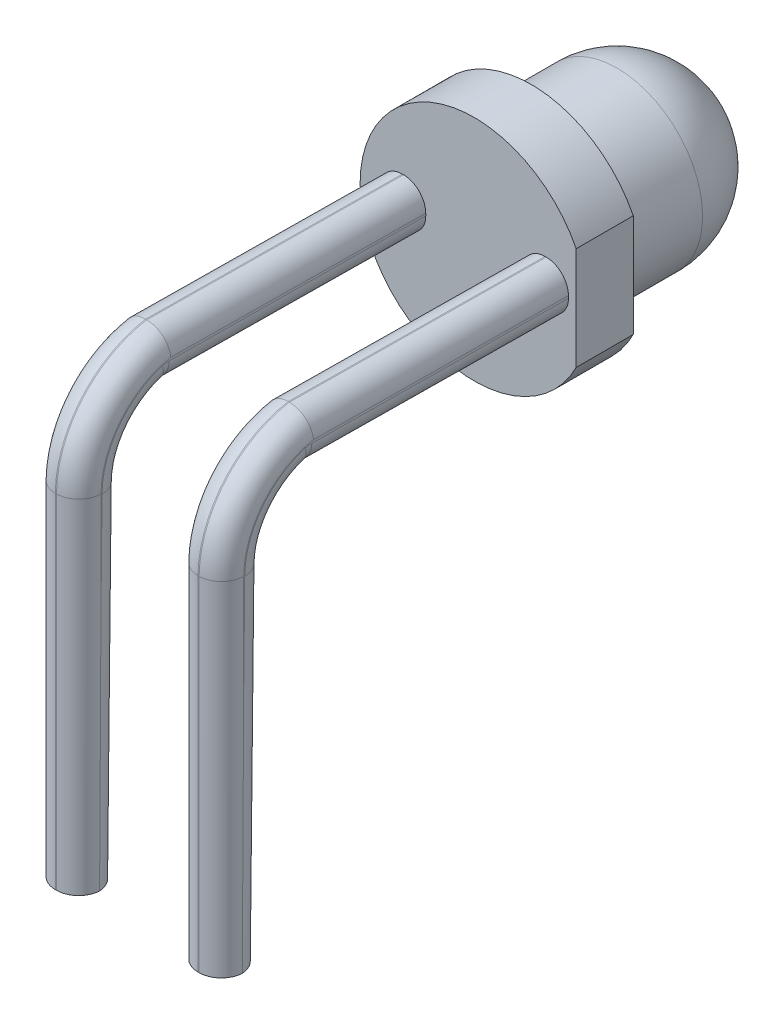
SolidWorks part; units mm, degrees
ref_plane "Face" through (0, 0, 0) normal (0, 0, 1) x (1, 0, 0)
ref_plane "Dessus" through (0, 0, 0) normal (0, 1, 0) x (1, 0, 0)
ref_plane "Droite" through (0, 0, 0) normal (1, 0, 0) x (0, 0, -1)
sketch "Esquisse1" plane through (0, 0, 0) normal (0, 0, 1) x (1, 0, 0)
  circle A0 centre (0, 0) radius 1.5
  dimension "D1" = 3
extrude "Base-Extrusion" add sketch "Esquisse1" along normal blind 4
sketch "Esquisse2" plane through (0, 0, 4) normal (0, 0, 1) x (1, 0, 0)
  line L0 (1.7857, -2.4917) -> (1.7857, 2.5621) construction
  line L1 (1.7857, 0.9007) -> (1.7857, -0.9007)
  arc A0 (1.7857, 0.9007) -> (1.7857, -0.9007) centre (0, 0) ccw
  dimension "D1" = 2
extrude "Boss.-Extru.1" add sketch "Esquisse2" against normal blind 1
fillet "Congé1" radius 1.5 1 edges at (1.5, 0, 0)
sketch "Esquisse4" plane through (0, 0, 0) normal (1, 0, 0) x (0, 0, -1)
  line L0 (1.383, 0) -> (-18.292, 0) construction
  line L1 (-8.5, 2.6212) -> (-8.5, -6.3201) construction
  line L2 (-12, 4.5057) -> (-12, -7.4301) construction
  line L3 (-13.5, 4.822) -> (-13.5, -7.8308) construction
  line L4 (-0.3251, -3) -> (-18.0389, -3) construction
  line L5 (-9.2808, -1.3065) -> (-9.3458, -7.3061)
  line L6 (-15.7458, -1.1795) -> (-1.7638, -1.4542) construction
  line L7 (-4, -0.3101) -> (-4, 0.5103)
  line L8 (-6, 4.1261) -> (-6, -7.641) construction
  line L9 (-9.3458, -7.3061) -> (-10.0807, -7.3061)
  line L10 (-4, -0.3101) -> (-8.5, -0.2613)
  line L11 (-10.0807, -7.3061) -> (-10.0807, -1.2908)
  line L12 (-4, 0.5103) -> (-8.5, 0.559)
  line L13 (-4, 2) -> (-4, -2) construction
  arc A0 (-8.5, -0.2613) -> (-9.2808, -1.3065) centre (-8.1809, -1.314) ccw
  arc A1 (-8.5, 0.559) -> (-10.0807, -1.2908) centre (-8.1809, -1.314) ccw
  dimension "D3" = 0.8
  dimension "D1" = 6
  dimension "D2" = 4.5
extrude "Boss.-Extru.2" add sketch "Esquisse4" along normal mid plane 3.3
sketch "Esquisse5" plane through (0, 0, 4) normal (0, 0, 1) x (1, 0, 0)
  line L0 (0, 2.2833) -> (0, -3.6189) construction
  line L1 (-0.85, 0.9378) -> (-0.85, -3.7624) construction
  line L2 (0.85, 0.8751) -> (0.85, -3.6906) construction
  line L4 (-0.85, 0.6239) -> (0.85, 0.6239)
  line L5 (-0.85, 0.6239) -> (-0.85, -17.2001)
  line L6 (-0.85, -17.2001) -> (0.85, -17.2001)
  line L7 (0.85, 0.6239) -> (0.85, -17.2001)
extrude "Enlèv. mat.-Extru.1" cut sketch "Esquisse5" along normal blind 10
fillet "Congé3" radius 0.39 28 edges at (-1.65, -0.6556, 9.0621) (-1.65, -0.2857, 6.25) (-1.65, 0.5346, 6.25) (-1.65, -0.0797, 9.6253) (-1.65, -4.2984, 10.0807) (-1.65, -7.3061, 9.7133) (-1.65, -4.3063, 9.3133) (1.65, -0.6556, 9.0621) (1.65, -0.2857, 6.25) (1.65, 0.5346, 6.25) (1.65, -0.0797, 9.6253) (1.65, -4.2984, 10.0807) (1.65, -7.3061, 9.7133) (1.65, -4.3063, 9.3133) (0.85, -4.3063, 9.3133) (-0.85, -4.3063, 9.3133) (-0.85, -0.6556, 9.0621) (-0.85, -0.2857, 6.25) (-0.85, 0.5346, 6.25) (-0.85, -0.0797, 9.6253) (-0.85, -4.2984, 10.0807) (-0.85, -7.3061, 9.7133) (0.85, -0.2857, 6.25) (0.85, -0.6556, 9.0621) (0.85, -7.3061, 9.7133) (0.85, -4.2984, 10.0807) (0.85, -0.0797, 9.6253) (0.85, 0.5346, 6.25)
